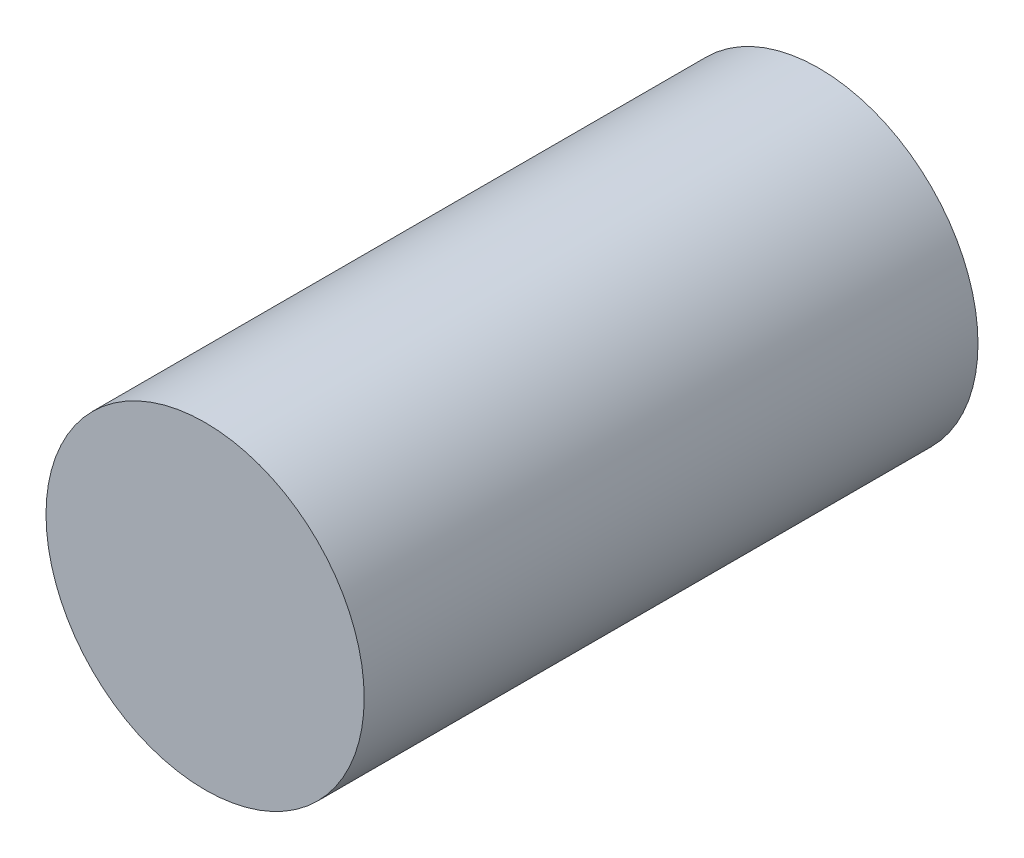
SolidWorks part; units mm, degrees
ref_plane "Plan1" through (0, 0, 0) normal (0, 0, 1) x (1, 0, 0)
ref_plane "Plan2" through (0, 0, 0) normal (0, 1, 0) x (1, 0, 0)
ref_plane "Plan3" through (0, 0, 0) normal (1, 0, 0) x (0, 0, -1)
sketch "Esquisse1" plane through (0, 0, 0) normal (0, 0, 1) x (1, 0, 0)
  circle A0 centre (-50, 50) radius 5
  dimension "D1" = 10
extrude "Base-Extrusion" add sketch "Esquisse1" along normal blind 19.29
